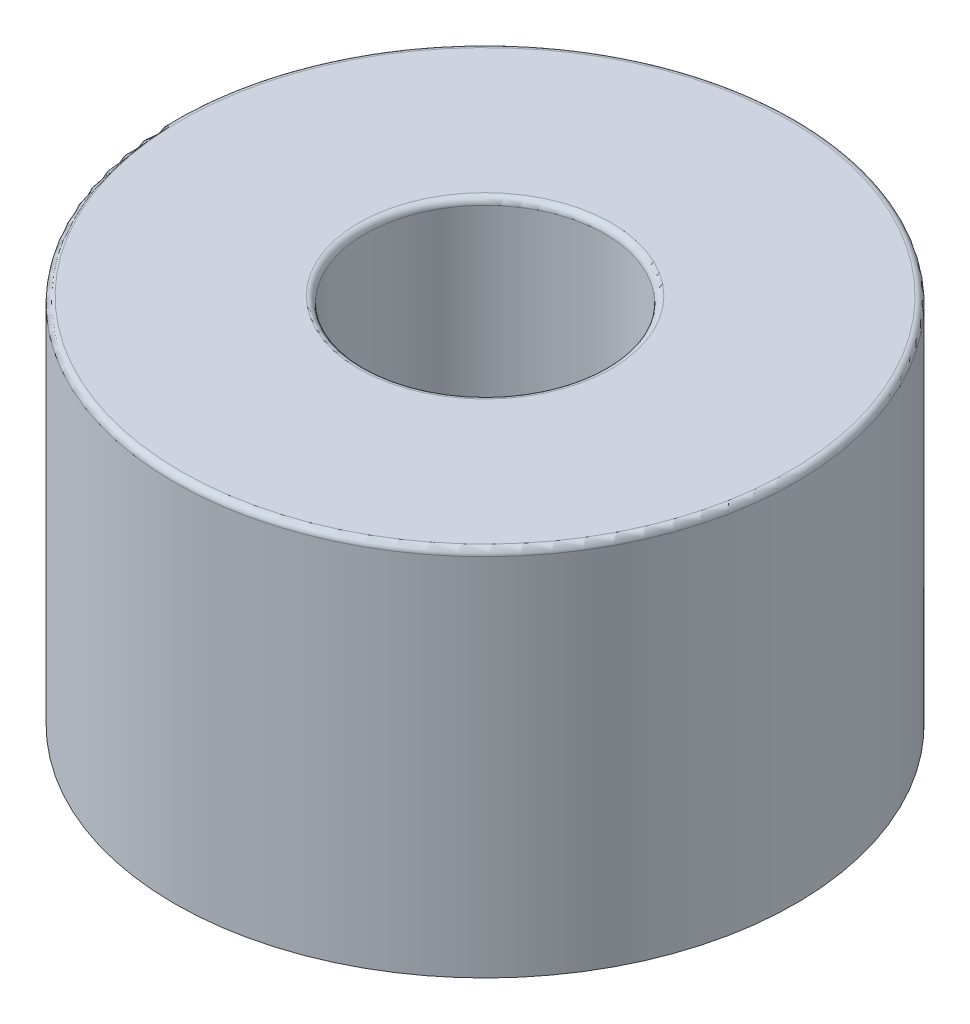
SolidWorks part; units mm, degrees
ref_plane "Front" through (0, 0, 0) normal (0, 0, 1) x (1, 0, 0)
ref_plane "Top" through (0, 0, 0) normal (0, 1, 0) x (1, 0, 0)
ref_plane "Right" through (0, 0, 0) normal (1, 0, 0) x (0, 0, -1)
sketch "Sketch1" plane through (0, 0, 0) normal (0, 1, 0) x (1, 0, 0)
  circle A0 centre (0, 0) radius 4.7625
  circle A1 centre (0, 0) radius 12.319
  dimension "D1" = 9.525
  dimension "D2" = 24.638
extrude "Boss-Extrude1" add sketch "Sketch1" along normal blind 14.732
fillet "Fillet1" radius 0.254 2 edges at (0, 14.732, 4.7625) (0, 14.732, 12.319)
